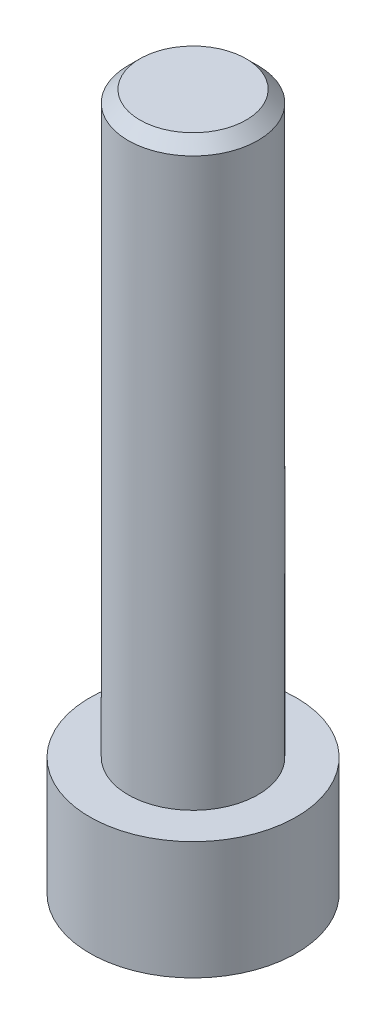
SolidWorks part; units mm, degrees
ref_plane "Plane1" through (0, 0, 0) normal (0, 0, 1) x (1, 0, 0)
ref_plane "Plane2" through (0, 0, 0) normal (0, 1, 0) x (1, 0, 0)
ref_plane "Plane3" through (0, 0, 0) normal (1, 0, 0) x (0, 0, -1)
imported_body "Imported1"
chamfer "Chamfer1" distance 0.254 angle 45
